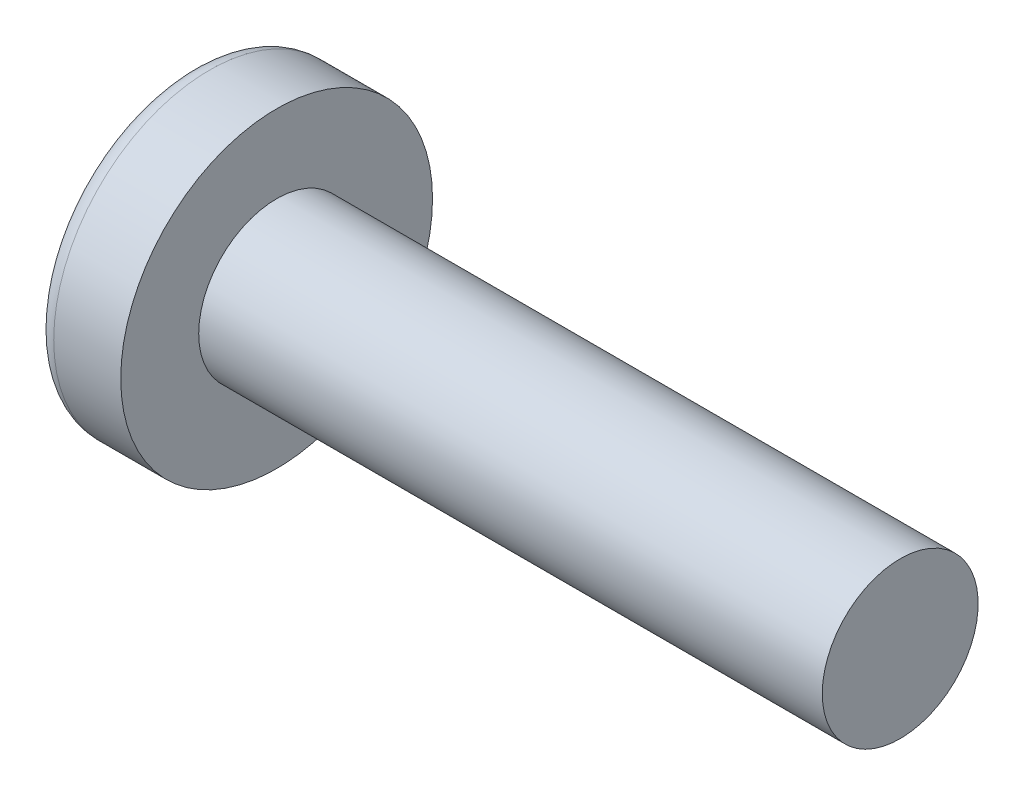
SolidWorks part; units mm, degrees
ref_plane "Plane1" through (0, 0, 0) normal (0, 0, 1) x (1, 0, 0)
ref_plane "Plane2" through (0, 0, 0) normal (0, 1, 0) x (1, 0, 0)
ref_plane "Plane3" through (0, 0, 0) normal (1, 0, 0) x (0, 0, -1)
sketch "BodySke" plane through (0, 0, 0) normal (0, 0, 1) x (1, 0, 0)
  line L0 (2.1, 1.25) -> (2.1, 2.5)
  line L1 (2.55, 6.35) -> (2.55, -3.175) construction
  line L2 (-25.4, 0) -> (127, 0) construction
  line L3 (12.1, 0) -> (0, 0)
  line L4 (2.1, 1.25) -> (12.1, 1.25)
  line L5 (12.1, 1.25) -> (12.1, 0)
  line L6 (1.0251, 2.5) -> (2.1, 2.5)
  line L7 (2.1, -1.25) -> (12.1, -1.25) construction
  line L8 (2.1, 6.35) -> (2.1, -3.175) construction
  arc A0 (0.7839, 2.3784) -> (0, 0) centre (4, 0) ccw
  arc A2 (0.7839, 2.3784) -> (1.0251, 2.5) centre (1.0251, 2.2) cw
revolve "Base-Revolve" add sketch "BodySke" angle 360 about L2
sketch "Sketch3" plane through (0, 0, 0) normal (1, 0, 0) x (0, 0, -1)
  line L0 (0.35, -1.34) -> (-0.35, -1.34)
  line L1 (0.35, -1.34) -> (0.35, 1.34)
  line L2 (-0.35, 1.34) -> (0.35, 1.34)
  line L3 (-0.35, 1.34) -> (-0.35, -1.34)
ref_plane "Plane4" through (1.53, 0, 0) normal (1, 0, 0) x (0, 0, -1)
sketch "Sketch4" plane through (1.53, 0, 0) normal (1, 0, 0) x (0, 0, -1)
  line L0 (0.175, -0.175) -> (-0.175, -0.175)
  line L1 (0.175, -0.175) -> (0.175, 0.175)
  line L2 (-0.175, 0.175) -> (0.175, 0.175)
  line L3 (-0.175, 0.175) -> (-0.175, -0.175)
loft "Cut-Loft1" cut profiles "Sketch3", "Sketch4"
pattern_circular "CirPattern1" count 2 every 90 about axis through (-25.4, 0, 0) along (1, 0, 0)
sketch "ThdSchSke" plane through (0, 0, 0) normal (0, 0, 1) x (1, 0, 0)
  line L0 (2.55, -0.9965) -> (2.3725, -1.25)
  line L1 (2.55, -0.9965) -> (2.7275, -1.25)
  line L2 (2.7275, -1.25) -> (2.7275, -1.5625)
  line L3 (-3.175, 0) -> (5.1513, 0) construction
  line L5 (2.7275, -1.5625) -> (2.3725, -1.5625)
  line L6 (2.3725, -1.5625) -> (2.3725, -1.25)
revolve "ThreadSchematic" [suppressed] cut sketch "ThdSchSke" angle 360 about L3
pattern_linear "ThdSchPat" [suppressed]
equation "\"D1@Sketch3\" = \"Cross_dia@Sketch3\" / 2"
equation "\"D2@Sketch3\" = \"Cross_width@Sketch3\" / 2"
equation "\"D1@Sketch4\" = \"Cross_width@Sketch3\" *.5"
equation "\"D2@Sketch4\" = \"D1@Sketch4\""
equation "\"D3@Sketch4\" = \"D1@Sketch4\" / 2"
equation "\"D4@Sketch4\" = \"D2@Sketch4\" / 2"
equation "\"Thread_length@ThreadCosmetic\" = ((sgn( (\"Length@BodySke\" - \"Advance@BodySke\" ) - \"Thread_nom@BodySke\" )-1)*( (\"Length@BodySke\" - \"Advance@BodySke\" ) - \"Thread_nom@BodySke\" ))/-2+ \"Thread_nom@BodySke\""
equation "\"Thread_minor@ThdSchSke\" = \"Thread_minor@ThreadCosmetic\""
equation "\"Diameter@ThdSchSke\" = \"Diameter@BodySke\""
equation "\"Overcut@ThdSchSke\" = \"Diameter@BodySke\" * 1.25"
equation "\"Start@ThdSchSke\" = \"Head_ht@BodySke\" + \"Length@BodySke\" - \"Thread_length@ThreadCosmetic\"  '---Non-countersunk---"
equation "\"Num_threads@ThdSchPat\" = int( \"Thread_length@ThreadCosmetic\" / \"Advance@BodySke\" + 0.999 )  + 1"
equation "\"Advance@ThdSchPat\" = \"Thread_length@ThreadCosmetic\" /  (\"Num_threads@ThdSchPat\" - 1) 'relax it"
